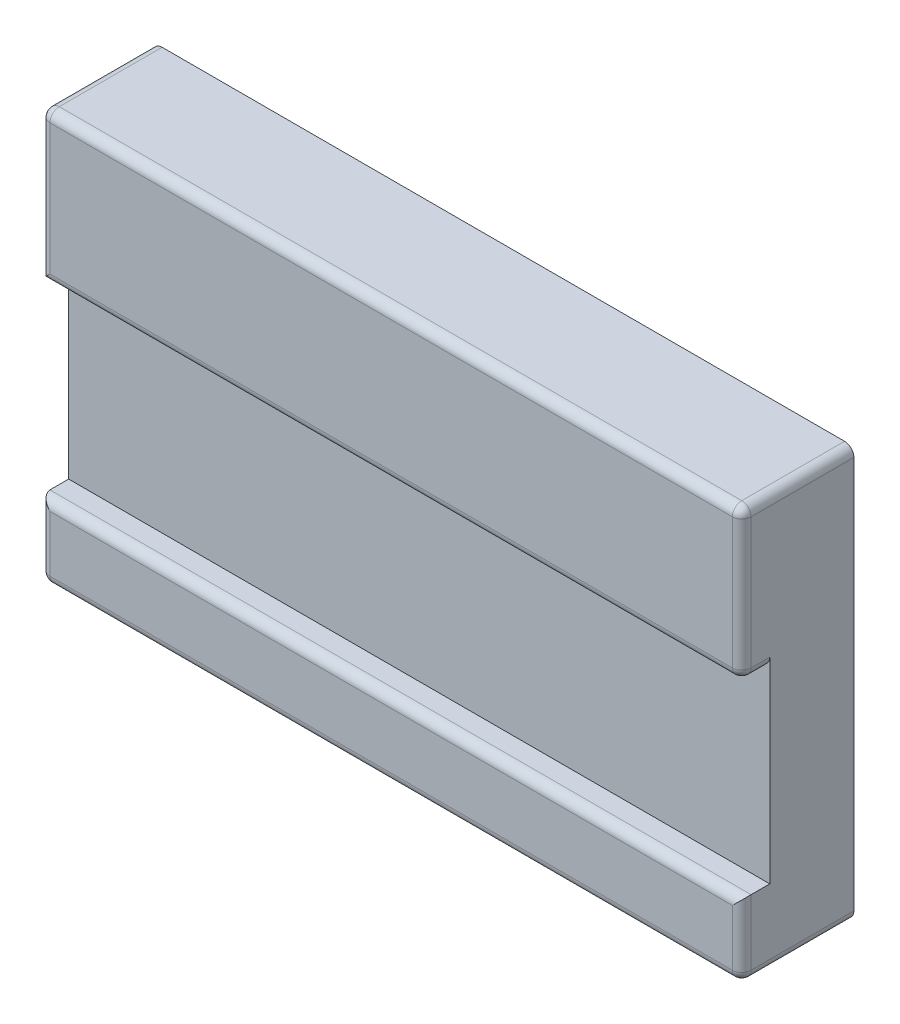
SolidWorks part; units mm, degrees
ref_plane "Plane1" through (0, 0, 0) normal (0, 0, 1) x (1, 0, 0)
ref_plane "Plane2" through (0, 0, 0) normal (0, 1, 0) x (1, 0, 0)
ref_plane "Plane3" through (0, 0, 0) normal (1, 0, 0) x (0, 0, -1)
sketch "Esquisse1" plane through (0, 0, 0) normal (0, 0, 1) x (1, 0, 0)
  line L0 (0, 0) -> (75, 0)
  line L1 (0, 0) -> (0, 44)
  line L2 (75, 44) -> (0, 44)
  line L3 (75, 44) -> (75, 0)
  dimension "D1" = 44
  dimension "D2" = 75
extrude "Base-Extrusion" add sketch "Esquisse1" along normal blind 12
sketch "Esquisse2" plane through (0, 0, 12) normal (0, 0, 1) x (1, 0, 0)
  line L0 (0, 28) -> (75, 28)
  line L1 (0, 28) -> (0, 8)
  line L2 (75, 8) -> (0, 8)
  line L3 (75, 8) -> (75, 28)
  line L4 (0, 0) -> (0, 44) construction
  line L5 (75, 44) -> (75, 0) construction
  line L6 (0, 0) -> (75, 0) construction
  dimension "D1" = 20
  dimension "D2" = 8
extrude "Enlèv. mat.-Extru.1" cut sketch "Esquisse2" against normal blind 3
sketch "Esquisse3" plane through (0, 0, 0) normal (0, -1, 0) x (1, 0, 0)
  line L0 (16, 0) -> (20, 0)
  line L1 (16, 0) -> (16, 5)
  line L2 (20, 5) -> (16, 5)
  line L3 (20, 5) -> (20, 0)
  line L4 (0, 0) -> (75, 0) construction
  line L5 (0, 12) -> (0, 0) construction
  dimension "D1" = 4
  dimension "D2" = 5
  dimension "D3" = 16
extrude "Boss.-Extru.1" add sketch "Esquisse3" along normal blind 5
sketch "Esquisse6" plane through (0, 0, 0) normal (0, -1, 0) x (1, 0, 0)
  line L0 (55, 0) -> (59, 0)
  line L1 (55, 0) -> (55, 5)
  line L2 (59, 5) -> (55, 5)
  line L3 (59, 5) -> (59, 0)
  line L4 (20, 0) -> (75, 0) construction
  line L5 (75, 12) -> (75, 0) construction
  dimension "D1" = 16
  dimension "D2" = 5
  dimension "D3" = 4
extrude "Boss.-Extru.2" add sketch "Esquisse6" along normal blind 5
sketch "Esquisse7" plane through (0, 0, 0) normal (0, 0, -1) x (-1, 0, 0)
  line L0 (-70, 6) -> (-39, 6)
  line L1 (-70, 6) -> (-70, 30)
  line L2 (-39, 30) -> (-70, 30)
  line L3 (-39, 30) -> (-39, 6)
  line L4 (-36, 6) -> (-5, 6)
  line L5 (-36, 6) -> (-36, 30)
  line L6 (-5, 30) -> (-36, 30)
  line L7 (-5, 30) -> (-5, 6)
  line L9 (0, 0) -> (0, 44) construction
  line L10 (-59, 0) -> (-75, 0) construction
  line L11 (0, 0) -> (-16, 0) construction
  dimension "D1" = 31
  dimension "D2" = 31
  dimension "D3" = 5
  dimension "D4" = 39
  dimension "D5" = 24
  dimension "D6" = 24
  dimension "D7" = 6
  dimension "D8" = 6
extrude "Enlèv. mat.-Extru.2" cut sketch "Esquisse7" against normal blind 7
fillet "Congé1" radius 1
fillet "Congé2" radius 1
chamfer "Chanfrein1" distance 1 angle 45
